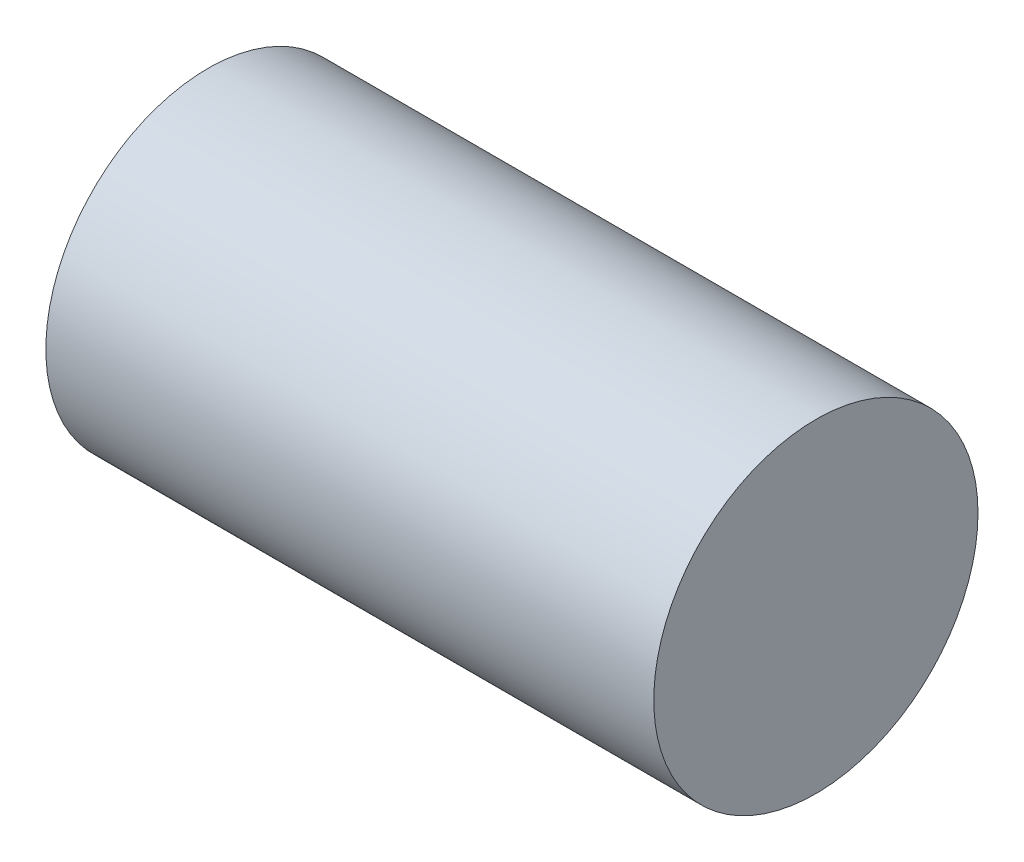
SolidWorks part; units mm, degrees
ref_plane "Front Plane" through (0, 0, 0) normal (0, 0, 1) x (1, 0, 0)
ref_plane "Top Plane" through (0, 0, 0) normal (0, 1, 0) x (1, 0, 0)
ref_plane "Right Plane" through (0, 0, 0) normal (1, 0, 0) x (0, 0, -1)
sketch "Sketch1" plane through (0, 0, 0) normal (1, 0, 0) x (0, 0, -1)
  circle A0 centre (0, 0) radius 4
  dimension "D1" = 8
extrude "Boss-Extrude1" add sketch "Sketch1" along normal blind 15
